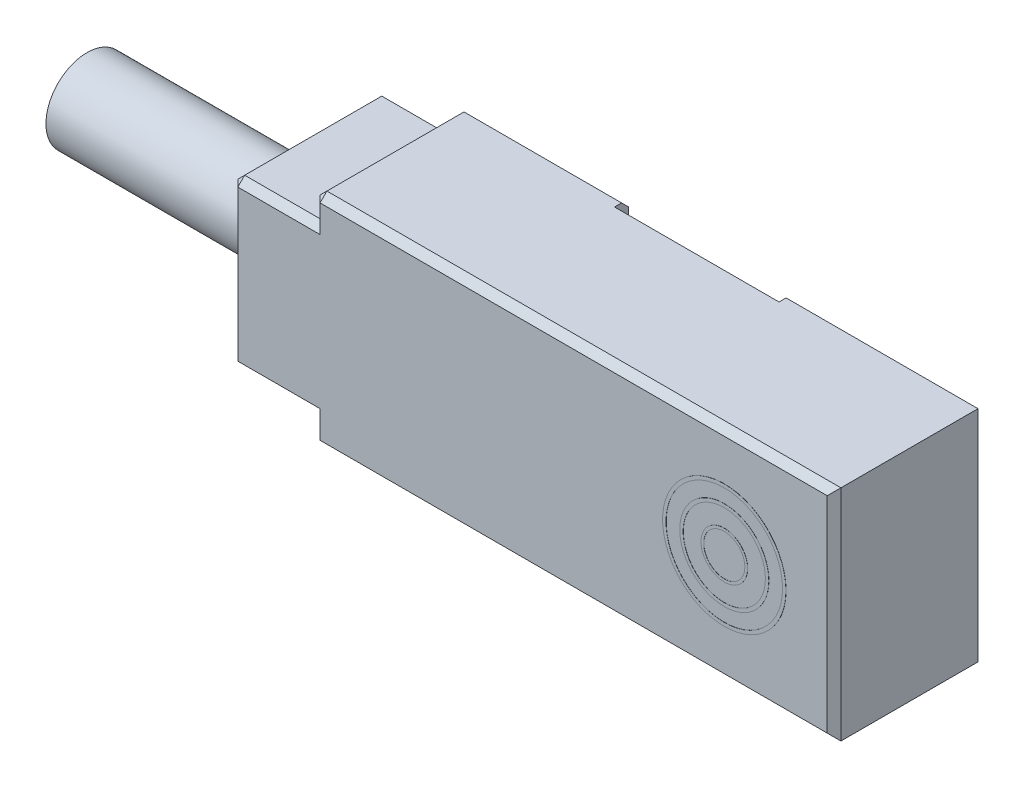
SolidWorks part; units mm, degrees
other "Boss-Extrude1"
ref_plane "Front" through (0, 0, 0) normal (0, 0, 1) x (1, 0, 0)
ref_plane "Top" through (0, 0, 0) normal (0, 1, 0) x (1, 0, 0)
ref_plane "Right" through (0, 0, 0) normal (1, 0, 0) x (0, 0, -1)
imported_body "Imported1"
sketch "Sketch1" plane through (0, 0, -2.75) normal (0, 0, -1) x (-1, 0, 0)
  line L0 (4.75, 4) -> (-14, 4) construction
  line L1 (-7, -2.25) -> (-1, -2.25)
  line L2 (-7, -2.25) -> (-7, 4)
  line L3 (-7, 4) -> (-1, 4)
  line L4 (-1, -2.25) -> (-1, 4)
extrude "Cut-Extrude1" cut sketch "Sketch1" against normal blind 0.508
